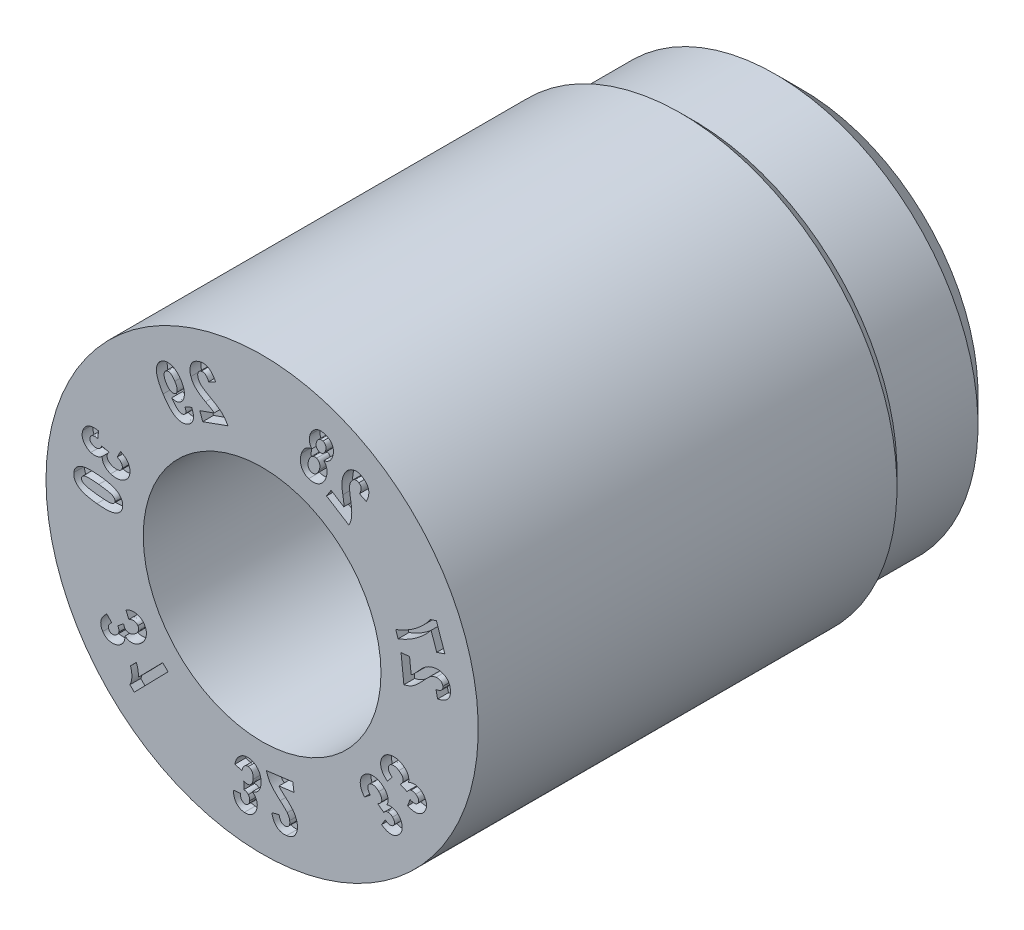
SolidWorks part; units mm, degrees
ref_plane "Front Plane" through (0, 0, 0) normal (0, 0, 1) x (1, 0, 0)
ref_plane "Top Plane" through (0, 0, 0) normal (0, 1, 0) x (1, 0, 0)
ref_plane "Right Plane" through (0, 0, 0) normal (1, 0, 0) x (0, 0, -1)
sketch "Sketch2" plane through (0, 0, 0) normal (0, 1, 0) x (1, 0, 0)
  line L0 (0, 4.8491) -> (0, -49995.1509) construction
  line L10 (3.2496, 10) -> (1.15, 10)
  line L11 (3.75, 9.4996) -> (3.2496, 10)
  line L12 (3.75, 8) -> (3.75, 9.4996)
  line L13 (4, 7.75) -> (3.75, 8)
  line L14 (4, 0) -> (4, 7.75)
  line L15 (2.2, 0) -> (4, 0)
  line L16 (2.2, 0) -> (2.2, 7.468)
  line L17 (1.15, 7.468) -> (2.2, 7.468)
  line L18 (1.15, 7.468) -> (1.15, 10)
  dimension "D1" = 8
  dimension "D2" = 4.4
  dimension "D3" = 2.532
  dimension "D4" = 2.3
  dimension "D5" = 7.5
  dimension "D6" = 10
  dimension "D7" = 45
  dimension "D8" = 45
  dimension "D9" = 2
  dimension "D10" = 0.5004
revolve "Revolve1" add sketch "Sketch2" angle 360 about L0
sketch "Sketch8" plane through (0, 0, 0) normal (0, 0, 1) x (1, 0, 0)
  line L0 (0, 0) -> (0, 4) construction
  line L1 (0, 0) -> (3.1273, 2.494) construction
  line L2 (0, 0) -> (3.8997, -0.8901) construction
  line L3 (0, 0) -> (1.7355, -3.6039) construction
  line L4 (0, 0) -> (-1.7355, -3.6039) construction
  line L5 (0, 0) -> (-3.8997, -0.8901) construction
  line L6 (0, 0) -> (-3.1273, 2.494) construction
  circle A0 centre (0, 0) radius 4 construction
  circle A30 centre (0, 0) radius 2.6264 construction
  text T0 "27    28    29    30    31    32    33" font "Arial Narrow" height 0.89
  point P12 (0, 0)
  dimension "D1" = 7
extrude "Cut-Extrude2" cut sketch "Sketch8" against normal blind 0.2
